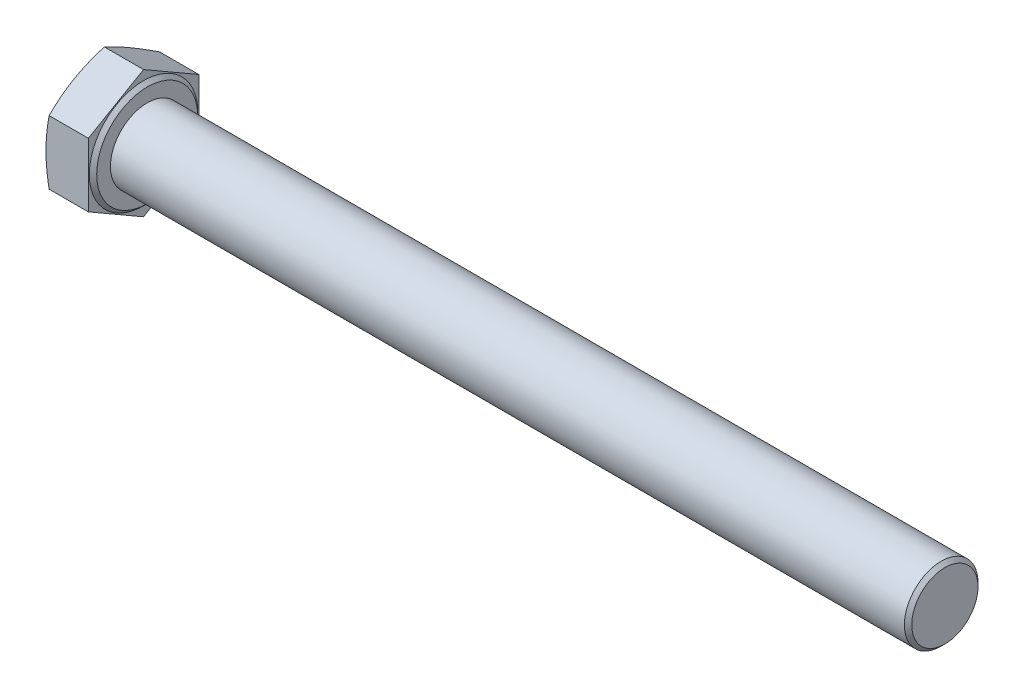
SolidWorks part; units mm, degrees
ref_plane "Front" through (0, 0, 0) normal (0, 0, 1) x (1, 0, 0)
ref_plane "Top" through (0, 0, 0) normal (0, 1, 0) x (1, 0, 0)
ref_plane "Right" through (0, 0, 0) normal (1, 0, 0) x (0, 0, -1)
sketch "Sketch2" plane through (0, 0, 0) normal (1, 0, 0) x (0, 0, -1)
  line L1 (0, -10.3923) -> (9, -5.1962)
  line L2 (9, -5.1962) -> (9, 5.1962)
  line L3 (9, 5.1962) -> (0, 10.3923)
  line L4 (0, 10.3923) -> (-9, 5.1962)
  line L5 (-9, 5.1962) -> (-9, -5.1962)
  line L6 (-9, -5.1962) -> (0, -10.3923)
  circle A0 centre (0, 0) radius 9 construction
  dimension "s" = 18
extrude "BaseHead" add sketch "Sketch2" along normal blind 7.5
sketch "Sketch3" plane through (0, 0, 0) normal (0, 0, 1) x (1, 0, 0)
  line L0 (7.5, 10.3923) -> (7.5, 8.235)
  line L2 (7.5, 8.235) -> (6.9, 8.835)
  line L3 (6.9, 8.835) -> (6.9, 10.3923)
  line L5 (6.9, 10.3923) -> (7.5, 10.3923)
  line L6 (-0.9571, 0) -> (7.6478, 0) construction
  line L7 (7.5, 10.3923) -> (0, 10.3923) construction
  dimension "D1" = 45
  dimension "c" = 0.6
  dimension "dw" = 16.47
revolve "BearingFace" cut sketch "Sketch3" angle 360 about L6
sketch "Sketch4" plane through (0, 0, 0) normal (0, 0, 1) x (1, 0, 0)
  line L0 (-0.4935, 0) -> (3.5626, 0) construction
  line L2 (0, 10.3923) -> (0.5068, 10.3923)
  line L4 (0.5068, 10.3923) -> (0, 9)
  line L6 (0, 9) -> (0, 10.3923)
  line L7 (6.9, 10.3923) -> (0, 10.3923) construction
  dimension "D1" = 20
  dimension "D2" = 18
revolve "HeadChamfer" cut sketch "Sketch4" angle 360 about L0
sketch "Sketch5" plane through (7.5, 0, 0) normal (1, 0, 0) x (0, 0, -1)
  circle A0 centre (0, 0) radius 6
  dimension "d" = 12
extrude "BaseBody" add sketch "Sketch5" along normal blind 130
chamfer "Chamfer1" distance 0.6 angle 45 1 edges at (137.5, 0, -6)
fillet "HeadFillet" [suppressed] radius 0.6
sketch "Sketch6" plane through (0, 0, 0) normal (0, 0, 1) x (1, 0, 0)
  line L0 (7.5, 6.947) -> (8.447, 6.947)
  line L1 (8.447, 6.947) -> (8.447, 6)
  line L2 (8.447, 6) -> (7.9735, 5.1799)
  line L3 (7.9735, 5.1799) -> (7.5, 6)
  line L4 (7.5, 6) -> (7.5, 6.947)
  line L5 (7.5, -8.235) -> (7.5, 8.235) construction
  line L6 (136.9, 6) -> (7.5, 6) construction
  dimension "D1" = 0.947
revolve "Cut-Revolve10" [suppressed] cut sketch "Sketch6" angle 360
pattern_linear "LPattern10" [suppressed] count 114
equation "\"D2@Sketch4\" = \"s@Sketch2\""
equation "\"D1@Chamfer1\" = 0.05 * \"d@Sketch5\""
equation "\"D1@Sketch6\" =  ( \"d@Sketch5\" - \"D2@ThreadCosmetic1\" )  / 2"
equation "\"pitch@LPattern10\" = 1.2 * \"D1@Sketch6\""
equation "\"D1@LPattern10\" = (  \"l@BaseBody\"-\"D1@Chamfer1\" )  / \"pitch@LPattern10\""
